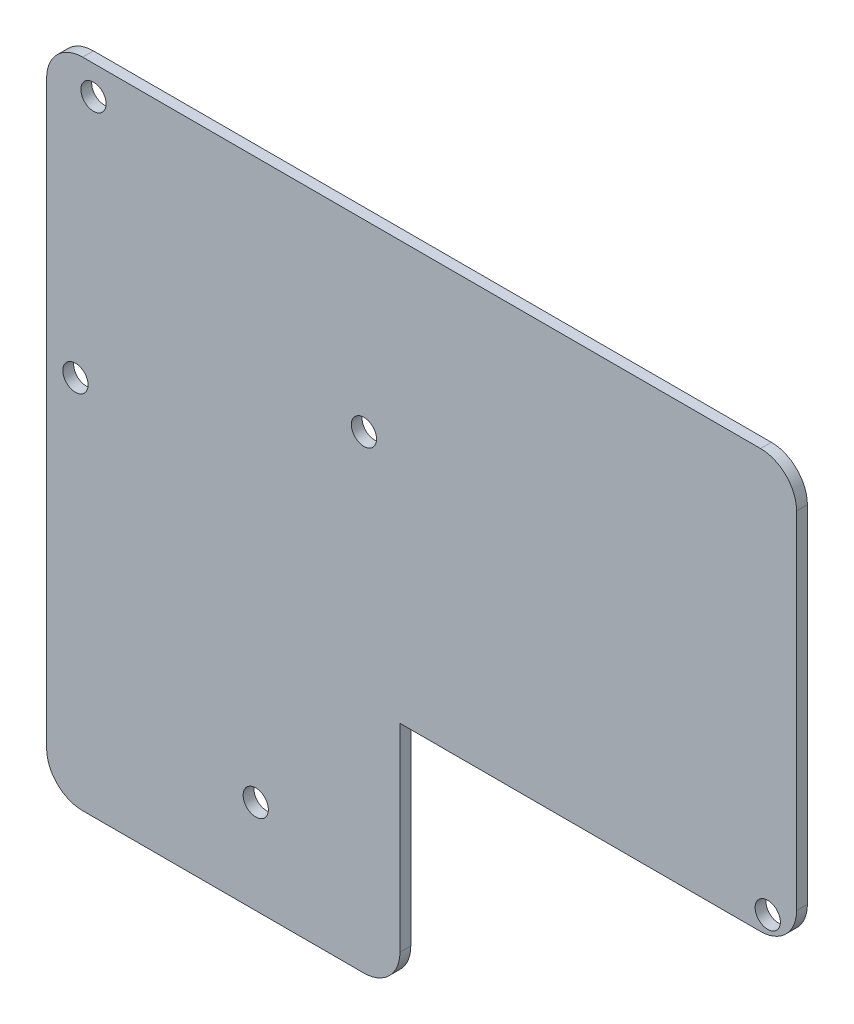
SolidWorks part; units mm, degrees
ref_plane "前基準面" through (0, 0, 0) normal (0, 0, 1) x (1, 0, 0)
ref_plane "上基準面" through (0, 0, 0) normal (0, 1, 0) x (1, 0, 0)
ref_plane "右基準面" through (0, 0, 0) normal (1, 0, 0) x (0, 0, -1)
sketch "草圖1" plane through (0, 0, 0) normal (0, 0, 1) x (1, 0, 0)
  line L0 (0, 0) -> (195, 0)
  line L1 (195, 0) -> (195, -90)
  line L2 (195, -90) -> (85, -90)
  line L3 (85, -90) -> (85, -155)
  line L4 (85, -155) -> (0, -155)
  line L5 (0, -155) -> (0, 0)
  line L12 (0, 13) -> (195, 13)
  line L13 (0, 0) -> (8, 0)
  line L14 (0, 0) -> (0, -65)
  line L17 (0, -155) -> (58, -155)
  line L18 (0, -155) -> (0, -142)
  line L21 (195, 0) -> (85, 0)
  line L22 (195, 0) -> (195, -61.792)
  line L25 (0, 0) -> (88, 0)
  line L26 (0, 0) -> (0, -38)
  line L27 (0, -38) -> (88, -38)
  line L28 (208, 0) -> (208, -103)
  line L29 (208, -103) -> (98, -103)
  line L30 (98, -103) -> (98, -168)
  line L31 (98, -168) -> (0, -168)
  line L32 (-13, -155) -> (-13, 0)
  line L33 (195, 13) -> (208, 13)
  line L34 (208, 13) -> (208, 0)
  line L35 (0, 13) -> (0, 0)
  line L36 (0, -155) -> (0, -168)
  line L38 (208, -103) -> (200, -103)
  line L39 (208, -103) -> (208, -98)
  circle A0 centre (8, -65) radius 3.5
  circle A1 centre (88, -38) radius 3.5
  circle A2 centre (58, -142) radius 3.5
  circle A3 centre (200, -98) radius 3.5
  dimension "D11" = 7
  dimension "D12" = 7
  dimension "D13" = 7
  dimension "D17" = 7
  dimension "D1" = 195
  dimension "D2" = 155
  dimension "D3" = 110
  dimension "D4" = 90
  dimension "D5" = 8
  dimension "D6" = 65
  dimension "D7" = 13
  dimension "D8" = 58
  dimension "D9" = 38
  dimension "D10" = 88
  dimension "D15" = 8
  dimension "D16" = 5
  dimension "D14" = 13
extrude "填料-伸長1" add sketch "草圖1" along normal blind 3
sketch "草圖2" plane through (0, 0, 3) normal (0, 0, 1) x (1, 0, 0)
  line L1 (0, 13) -> (13, 13)
  line L2 (0, 13) -> (0, 5)
  circle A0 centre (13, 5) radius 3.5
  dimension "D3" = 7
  dimension "D1" = 8
  dimension "D2" = 13
extrude "除料-伸長1" cut sketch "草圖2" against normal through all contours A0
fillet "圓角1" radius 10 1 edges at (208, 13, 1.5)
fillet "圓角2" radius 10 1 edges at (0, 13, 1.5)
fillet "圓角3" radius 10 3 edges at (0, -168, 1.5) (98, -168, 1.5) (208, -103, 1.5)
